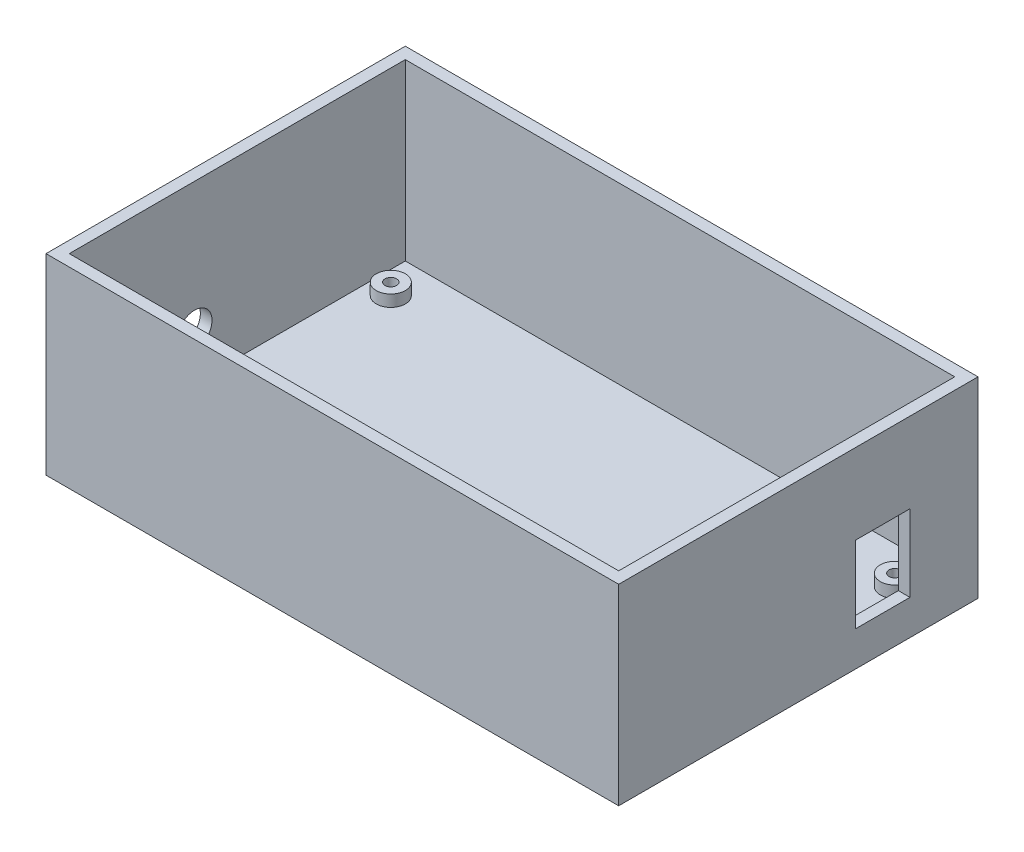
SolidWorks part; units mm, degrees
ref_plane "Front Plane" through (0, 0, 0) normal (0, 0, 1) x (1, 0, 0)
ref_plane "Top Plane" through (0, 0, 0) normal (0, 1, 0) x (1, 0, 0)
ref_plane "Right Plane" through (0, 0, 0) normal (1, 0, 0) x (0, 0, -1)
ref_plane "Plane1" through (0, -5, 0) normal (0, -1, 0) x (-1, 0, 0)
sketch "Sketch1" plane through (0, -5, 0) normal (0, -1, 0) x (-1, 0, 0)
  line L0 (-45.85, -25.05) -> (-45.85, 25.05) construction
  line L1 (49.25, -30.85) -> (-49.25, -30.85)
  line L2 (49.25, -30.85) -> (49.25, 30.95)
  line L3 (49.25, 30.95) -> (-49.25, 30.95)
  line L4 (-49.25, -30.85) -> (-49.25, 30.95)
  line L5 (-29.35, -27.45) -> (45.85, -27.45) construction
  line L6 (45.85, 25.05) -> (45.85, -25.05) construction
  line L7 (-29.35, 27.55) -> (45.85, 27.55) construction
  dimension "D1" = 3.4
  dimension "D2" = 3.4
  dimension "D3" = 3.4
  dimension "D4" = 3.4
extrude "Boss-Extrude1" add sketch "Sketch1" against normal blind 3
sketch "Sketch2" plane through (0, -2, 0) normal (0, 1, 0) x (1, 0, 0)
  circle A0 centre (-43.35, 22.55) radius 2.5
  circle A1 centre (-43.35, -22.55) radius 2.5
  circle A2 centre (43.35, -22.55) radius 2.5
  circle A3 centre (43.35, 22.55) radius 2.5
  dimension "D1" = 5
  dimension "D2" = 5
  dimension "D3" = 5
  dimension "D4" = 5
extrude "Boss-Extrude2" add sketch "Sketch2" along normal blind 2
sketch "Sketch3" plane through (0, -2, 0) normal (0, 1, 0) x (1, 0, 0)
  line L4 (49.25, -30.85) -> (49.25, 30.95)
  line L5 (49.25, 30.95) -> (-49.25, 30.95)
  line L6 (-49.25, 30.95) -> (-49.25, -30.85)
  line L7 (-49.25, -30.85) -> (49.25, -30.85)
  line L8 (-47.25, 28.95) -> (-47.25, -28.85)
  line L9 (-47.25, -28.85) -> (47.25, -28.85)
  line L10 (47.25, -28.85) -> (47.25, 28.95)
  line L11 (47.25, 28.95) -> (-47.25, 28.95)
  line L12 (-47.25, 28.95) -> (-47.25, -28.85)
  line L13 (-47.25, -28.85) -> (47.25, -28.85)
  line L14 (47.25, -28.85) -> (47.25, 28.95)
  line L15 (47.25, 28.95) -> (-47.25, 28.95)
  dimension "D1" = 2
  dimension "D2" = 2
extrude "Boss-Extrude3" add sketch "Sketch3" along normal blind 30
sketch "Sketch4" plane through (49.25, 0, 0) normal (1, 0, 0) x (0, 0, -1)
  line L0 (19.05, 1.2) -> (10.05, 1.2) construction
  line L1 (9.85, 1) -> (19.25, 1)
  line L2 (9.85, 1) -> (9.85, 14.2)
  line L3 (9.85, 14.2) -> (19.25, 14.2)
  line L4 (19.25, 1) -> (19.25, 14.2)
  line L5 (9.85, 1) -> (19.25, 14.2) construction
  line L6 (9.85, 14.2) -> (19.25, 1) construction
  line L7 (10.05, 12.2) -> (10.05, 1.2) construction
  line L8 (19.05, 12.2) -> (19.05, 1.2) construction
  line L9 (19.05, 12.2) -> (10.05, 12.2) construction
  point P0 (14.55, 7.6)
  dimension "D1" = 0.2
  dimension "D2" = 0.2
  dimension "D3" = 0.2
  dimension "D4" = 2
extrude "Cut-Extrude1" cut sketch "Sketch4" against normal blind 2
sketch "Sketch5" plane through (0, 0, 0) normal (0, 1, 0) x (1, 0, 0)
  circle A0 centre (43.35, 22.55) radius 1
  circle A1 centre (43.35, -22.55) radius 1
  circle A2 centre (-43.35, -22.55) radius 1
  circle A3 centre (-43.35, 22.55) radius 1
  dimension "D1" = 2
  dimension "D2" = 2
  dimension "D3" = 2
  dimension "D4" = 2
extrude "Cut-Extrude2" cut sketch "Sketch5" against normal blind 3
sketch "Sketch6" plane through (-49.25, 0, 0) normal (-1, 0, 0) x (0, 0, 1)
  circle A0 centre (7.3, 5.8) radius 3
  dimension "D1" = 6
extrude "Cut-Extrude3" cut sketch "Sketch6" against normal blind 6.6
